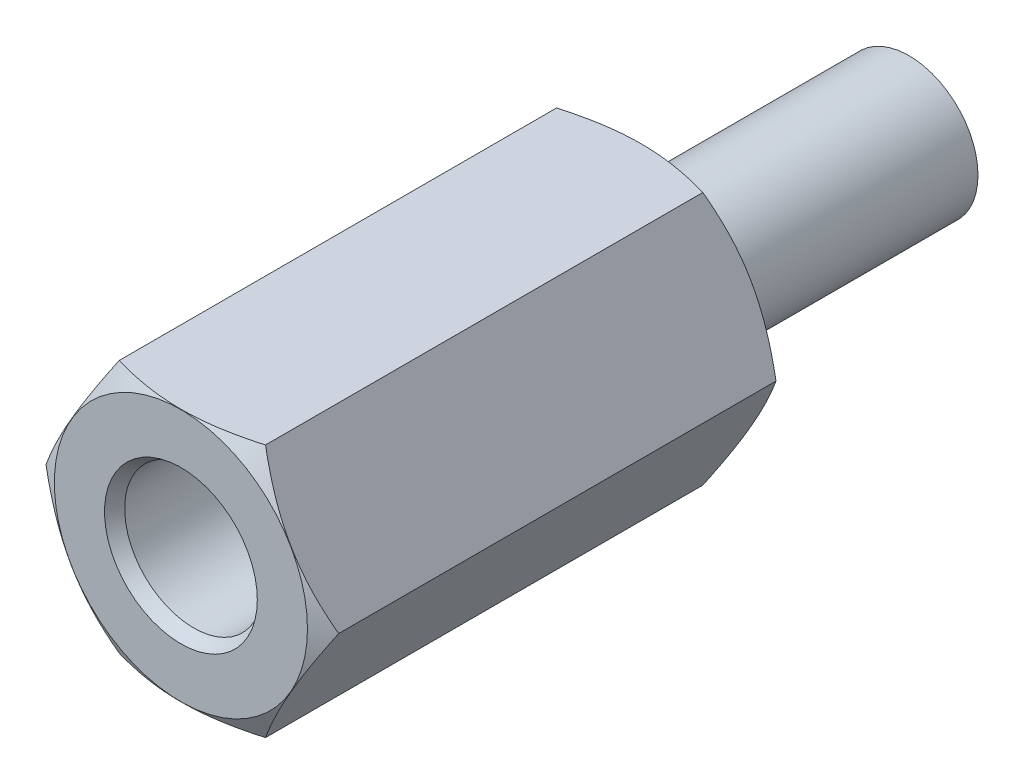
SolidWorks part; units mm, degrees
ref_plane "Front Plane" through (0, 0, 0) normal (0, 0, 1) x (1, 0, 0)
ref_plane "Top Plane" through (0, 0, 0) normal (0, 1, 0) x (1, 0, 0)
ref_plane "Right Plane" through (0, 0, 0) normal (1, 0, 0) x (0, 0, -1)
imported_body "hexagonal_spacer_MF_M3_H10_HEX5.5_FTD6_MTL6.step<1>"
scale "Scale1" scale about centroid uniform scaling yes scale factor 2
